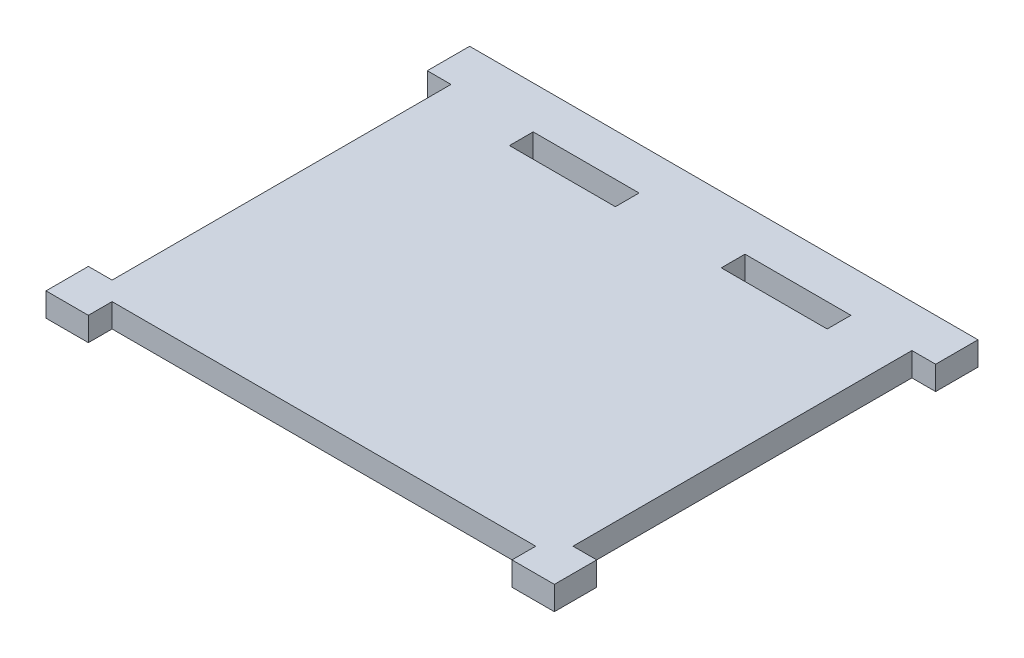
SolidWorks part; units mm, degrees
ref_plane "Front Plane" through (0, 0, 0) normal (0, 0, 1) x (1, 0, 0)
ref_plane "Top Plane" through (0, 0, 0) normal (0, 1, 0) x (1, 0, 0)
ref_plane "Right Plane" through (0, 0, 0) normal (1, 0, 0) x (0, 0, -1)
sketch "Sketch1" plane through (0, 0, 0) normal (0, 1, 0) x (1, 0, 0)
  line L0 (0, 50) -> (0, 45) construction
  line L1 (0, 0) -> (60, 0)
  line L2 (0, 0) -> (0, 50)
  line L3 (0, 50) -> (60, 50)
  line L4 (60, 0) -> (60, 50)
  line L5 (0, 45) -> (12.5, 45) construction
  line L6 (12.5, 45) -> (25, 45) construction
  line L7 (25, 45) -> (37.5, 45) construction
  line L8 (37.5, 45) -> (50, 45) construction
  line L10 (12.5, 45) -> (25, 45)
  line L11 (12.5, 45) -> (12.5, 42.2)
  line L12 (12.5, 42.2) -> (25, 42.2)
  line L13 (25, 45) -> (25, 42.2)
  line L14 (37.5, 45) -> (50, 45)
  line L15 (37.5, 45) -> (37.5, 42.2)
  line L16 (37.5, 42.2) -> (50, 42.2)
  line L17 (50, 45) -> (50, 42.2)
extrude "Boss-Extrude1" add sketch "Sketch1" along normal blind 2.8
sketch "Sketch3" plane through (0, 2.8, 0) normal (0, 1, 0) x (1, 0, 0)
  line L0 (0, 50) -> (0, 45) construction
  line L1 (0, 50) -> (0, 0) construction
  line L2 (0, 0) -> (0, 5) construction
  line L3 (0, 0) -> (5, 0) construction
  line L4 (0, 0) -> (60, 0) construction
  line L5 (60, 0) -> (55, 0) construction
  line L6 (60, 0) -> (60, 5) construction
  line L7 (60, 0) -> (60, 50) construction
  line L8 (60, 50) -> (60, 45) construction
  line L10 (0, 45) -> (2.8, 45)
  line L11 (0, 45) -> (0, 5)
  line L12 (0, 5) -> (2.8, 5)
  line L13 (2.8, 45) -> (2.8, 5)
  line L14 (5, 0) -> (55, 0)
  line L15 (5, 0) -> (5, 2.8)
  line L16 (5, 2.8) -> (55, 2.8)
  line L17 (55, 0) -> (55, 2.8)
  line L18 (60, 5) -> (57.2, 5)
  line L19 (60, 5) -> (60, 45)
  line L20 (60, 45) -> (57.2, 45)
  line L21 (57.2, 5) -> (57.2, 45)
extrude "Cut-Extrude2" cut sketch "Sketch3" against normal blind 2.8
